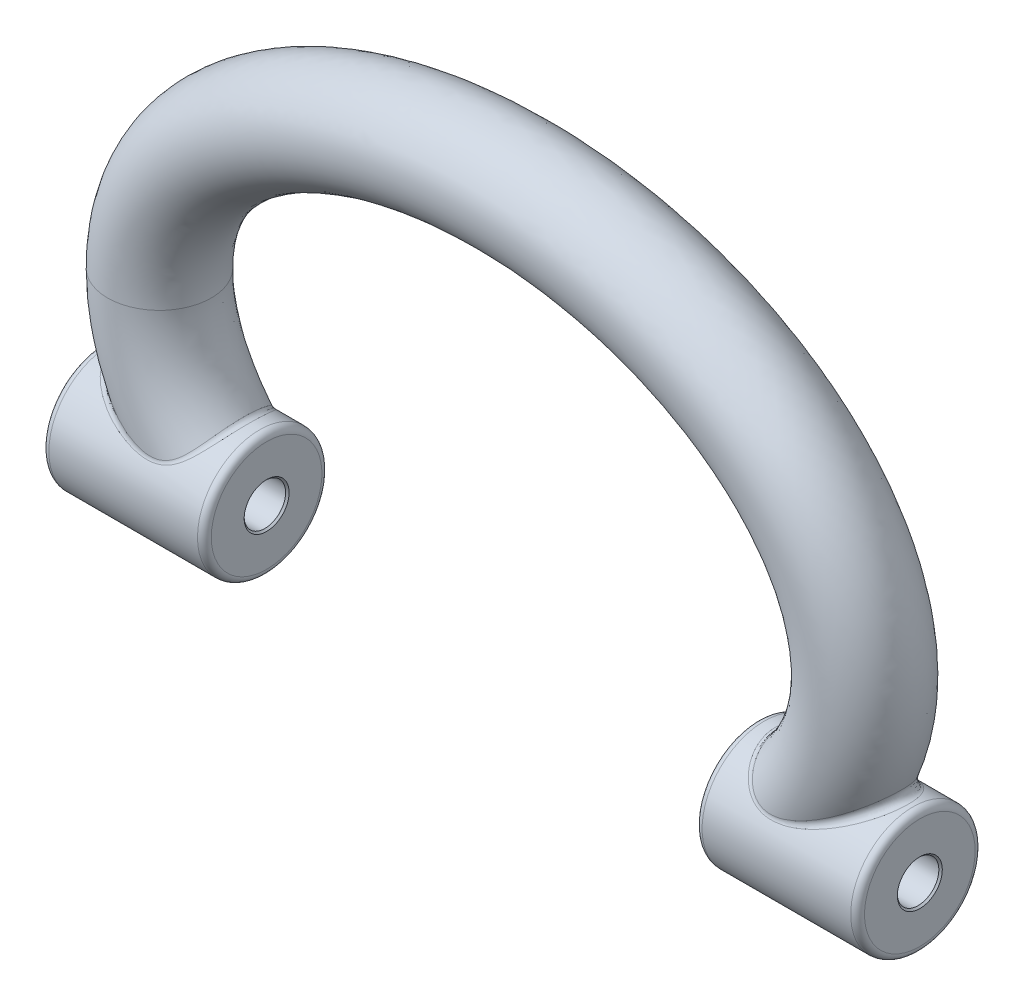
SolidWorks part; units mm, degrees
ref_plane "Спереди" through (0, 0, 0) normal (0, 0, 1) x (1, 0, 0)
ref_plane "Сверху" through (0, 0, 0) normal (0, 1, 0) x (1, 0, 0)
ref_plane "Справа" through (0, 0, 0) normal (1, 0, 0) x (0, 0, -1)
sketch "Эскиз3" plane through (0, 0, 0) normal (0, 0, 1) x (1, 0, 0)
  line L0 (-40.3688, 0) -> (40.3688, 0) construction
  ellipse E0 centre (0, 22) end of major axis (-51, 22) minor radius 36 (40.3688, 0) -> (-40.3688, 0) ccw
  dimension "D1" = 22
  dimension "D2" = 102
  dimension "D3" = 72
ref_plane "Плоскость2" through (0, 22, 0) normal (0, 1, 0) x (-1, 0, 0)
sketch "Эскиз5" plane through (0, 22, 0) normal (0, 1, 0) x (-1, 0, 0)
  circle A0 centre (51, 0) radius 7.5
  dimension "D1" = 15
sweep "По траектории1" add profiles "Эскиз5" path "Эскиз3"
sketch "Эскиз6" plane through (0, 22, 0) normal (0, 1, 0) x (-1, 0, 0)
  circle A1 centre (51, 0) radius 7.5
  circle A2 centre (51, 0) radius 7.5
  dimension "D1" = 0
sketch "Эскиз7" plane through (0, 0, 0) normal (0, 0, 1) x (1, 0, 0)
  line L0 (-51, 22) -> (0, 22) construction
  ellipse E0 centre (0, 22) end of major axis (-51, 22) minor radius 36 (40.3688, 0) -> (-40.3688, 0) ccw construction
  ellipse E1 centre (0, 22) end of major axis (-51, 22) minor radius 36 (-51, 22) -> (-40.3688, 0) ccw
sweep "По траектории2" add profiles "Эскиз6" path "Эскиз7"
sketch "Эскиз1" plane through (0, 0, 0) normal (1, 0, 0) x (0, 0, -1)
  circle A0 centre (0, 0) radius 3 construction
  circle A1 centre (0, 0) radius 9
  dimension "D1" = 18
  dimension "D2" = 6
extrude "Бобышка-Вытянуть1" add sketch "Эскиз1" along normal mid plane 118
sketch "Эскиз2" plane through (0, 0, 0) normal (0, 0, 1) x (1, 0, 0)
  line L0 (-59, -9) -> (59, -9) construction
  line L1 (35.5, 9) -> (-35.5, 9)
  line L2 (35.5, 9) -> (35.5, -9)
  line L3 (35.5, -9) -> (-35.5, -9)
  line L4 (-35.5, 9) -> (-35.5, -9)
  line L5 (35.5, 9) -> (-35.5, -9) construction
  line L6 (35.5, -9) -> (-35.5, 9) construction
  point P0 (0, 0)
  dimension "D1" = 71
extrude "Вырез-Вытянуть1" cut sketch "Эскиз2" against normal mid plane 20
sketch "Эскиз8" plane through (0, 0, 0) normal (1, 0, 0) x (0, 0, -1)
  circle A0 centre (0, 0) radius 3 construction
  circle A1 centre (0, 0) radius 3
extrude "Вырез-Вытянуть2" cut sketch "Эскиз8" against normal mid plane 130
fillet "Скругление1" radius 1 3 edges at (-35.5, 0, 9) (-59, 0, -9) (-43.3696, 5.1525, -7.3792)
fillet "Скругление2" radius 1 3 edges at (59, 0, -9) (35.5, 0, -9) (43.3664, 5.1544, -7.3778)
chamfer "Фаска1" distance 0.25 angle 45 2 edges at (59, 0, -3) (35.5, 0, -3)
chamfer "Фаска2" distance 0.25 angle 45 2 edges at (-59, 0, -3) (-35.5, 0, 3)
